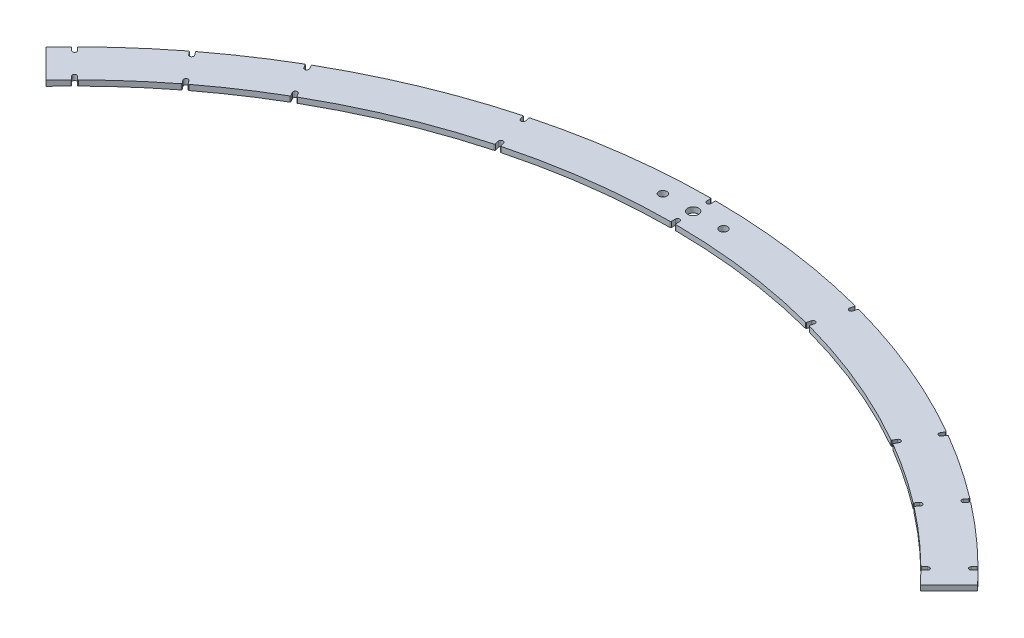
SolidWorks part; units mm, degrees
other "<Rotaladef02b>-<Estrusione-Estrusione1>"
ref_plane "Piano frontale" through (0, 0, 0) normal (0, 0, 1) x (1, 0, 0)
ref_plane "Piano superiore" through (0, 0, 0) normal (0, 1, 0) x (1, 0, 0)
ref_plane "Piano destro" through (0, 0, 0) normal (1, 0, 0) x (0, 0, -1)
mirrored part "Rotaladef02b_Specchiato"
